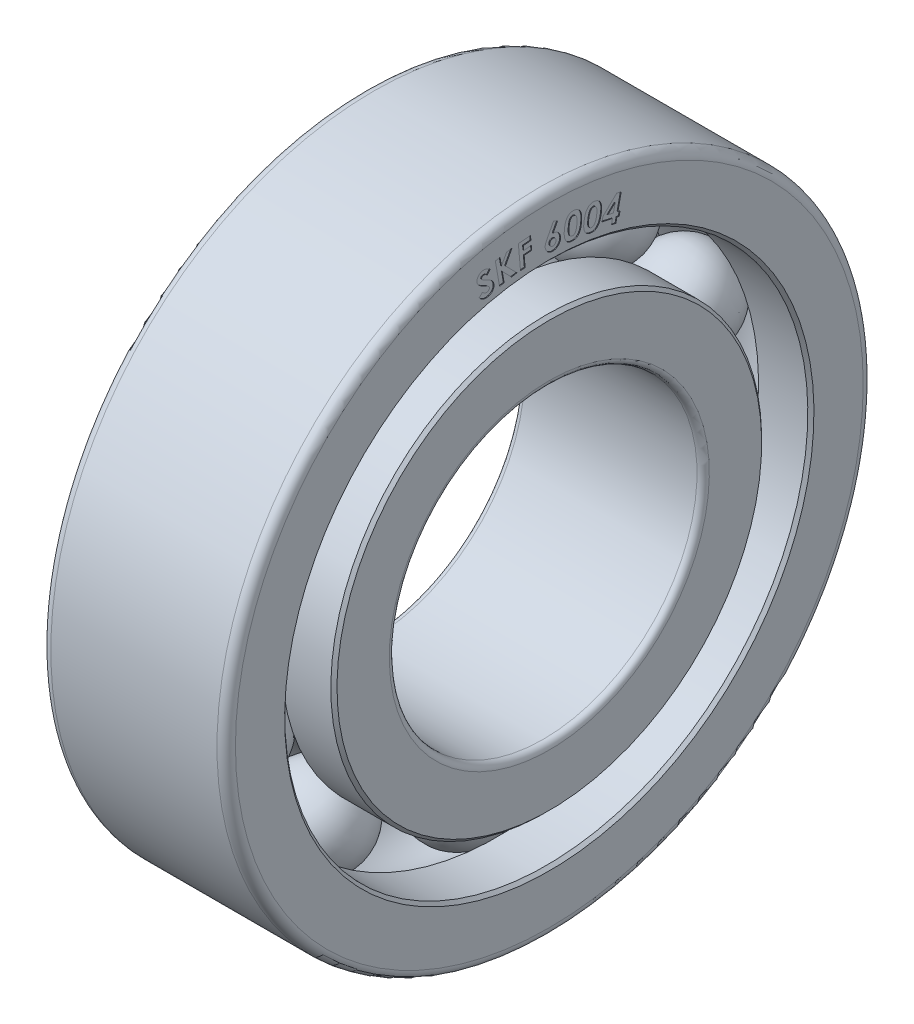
SolidWorks part; units mm, degrees
ref_plane "Front" through (0, 0, 0) normal (0, 0, 1) x (1, 0, 0)
ref_plane "Top" through (0, 0, 0) normal (0, 1, 0) x (1, 0, 0)
ref_plane "Right" through (0, 0, 0) normal (1, 0, 0) x (0, 0, -1)
sketch "Sketch1" plane through (0, 0, 0) normal (0, 0, 1) x (1, 0, 0)
  line L0 (0, 0) -> (-12, 0) construction
  line L1 (-8.5981, 14) -> (-11.8, 14)
  line L2 (-0.4, 10) -> (-11.6, 10)
  line L3 (0, 10.4) -> (0, 13.8)
  line L4 (-0.2, 14) -> (-3.4019, 14)
  line L5 (-12, 10.4) -> (-12, 13.8)
  line L6 (-11.8, 14) -> (-12, 13.8)
  line L7 (0, 13.8) -> (-0.2, 14)
  line L8 (-12, 13.5564) -> (-12, 13.8)
  line L9 (-11.4, 21) -> (-0.6, 21)
  line L10 (0, 13.186) -> (0, 13.8)
  line L11 (-11.8, 17) -> (-8.5981, 17)
  line L12 (-12, 17.2) -> (-12, 20.4)
  line L13 (-3.4019, 17) -> (-0.2, 17)
  line L14 (0, 17.2) -> (0, 20.4)
  line L15 (-12, 17.2) -> (-11.8, 17)
  line L16 (-0.2, 17) -> (0, 17.2)
  arc A0 (-3.4019, 17) -> (-8.5981, 17) centre (-6, 15.5) ccw
  arc A1 (-11.6, 10) -> (-12, 10.4) centre (-11.6, 10.4) cw
  arc A2 (0, 10.4) -> (-0.4, 10) centre (-0.4, 10.4) cw
  arc A3 (-8.5981, 14) -> (-3.4019, 14) centre (-6, 15.5) ccw
  arc A4 (-0.6, 21) -> (0, 20.4) centre (-0.6, 20.4) cw
  arc A5 (-12, 20.4) -> (-11.4, 21) centre (-11.4, 20.4) cw
  point P4 (-12, 14)
  point P5 (0, 14)
  point P12 (-12, 10)
  point P15 (0, 10)
  point P28 (-12, 17)
  point P29 (0, 17)
  dimension "D5" = 6
  dimension "D8" = 0.4
  dimension "D13" = 0.6
  dimension "D2" = 15.5
  dimension "D3" = 10
  dimension "D4" = 4
  dimension "D6" = 5.5
  dimension "D7" = 12
  dimension "D9" = 4
  dimension "D10" = 21
  dimension "D14" = 6
revolve "Revolve1" add sketch "Sketch1" angle 360 about L0
sketch "Sketch3" plane through (0, 0, 0) normal (0, 0, 1) x (1, 0, 0)
  line L0 (-6, 18.5) -> (-6, 12.5)
  arc A0 (-6, 12.5) -> (-6, 18.5) centre (-6, 15.5) ccw
  dimension "D3" = 6
  dimension "D1" = 15.5
  dimension "D2" = 6
revolve "Revolve3" add sketch "Sketch3" angle 360 about L0
pattern_circular "CirPattern1" count 10 over 360 about axis through (0, 0, 0) along (1, 0, 0)
sketch "Sketch8" plane through (0, 0, 0) normal (1, 0, 0) x (0, 0, -1)
  line L0 (0, 0) -> (0, 17.6218) construction
  line L1 (0, 0) -> (-8.8109, 15.2609) construction
  line L2 (0, 0) -> (8.8109, 15.2609) construction
  arc A0 (8.8109, 15.2609) -> (-8.8109, 15.2609) centre (0, 0) ccw construction
  text T0 "SKF 6004" font "Century Gothic" height 1.6
  dimension "D1" = 30
wrap "Wrap1" sketch "Sketch8" wrap type deboss source sketch "Sketch8" thickness 0.05 parameters "D1"=0.05
ref_plane "Plane1" through (-0.5, 0, 0) normal (1, 0, 0) x (0, 0, -1)
